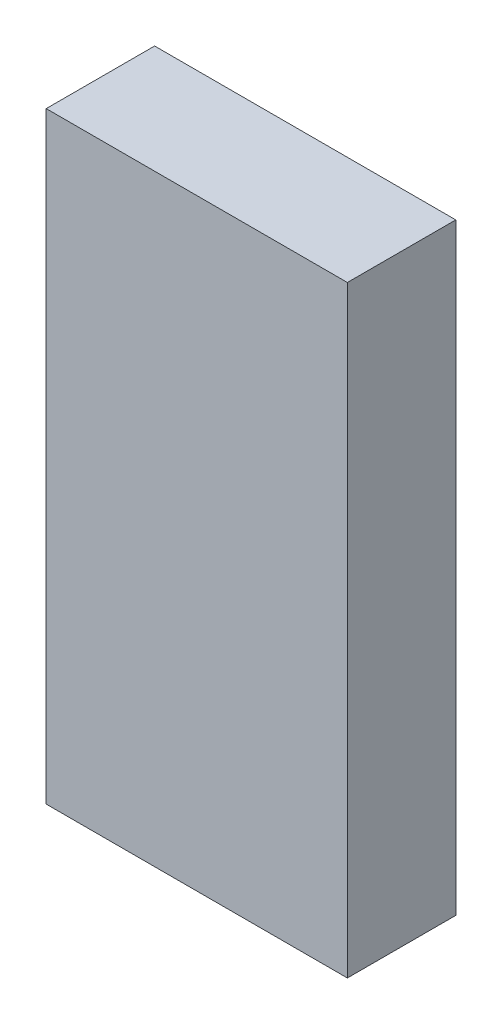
SolidWorks part; units mm, degrees
ref_plane "Front Plane" through (0, 0, 0) normal (0, 0, 1) x (1, 0, 0)
ref_plane "Top Plane" through (0, 0, 0) normal (0, 1, 0) x (1, 0, 0)
ref_plane "Right Plane" through (0, 0, 0) normal (1, 0, 0) x (0, 0, -1)
sketch "Sketch1" plane through (0, 0, 0) normal (0, 0, 1) x (1, 0, 0)
  line L1 (-50, 100) -> (50, 100)
  line L2 (-50, 100) -> (-50, -100)
  line L3 (-50, -100) -> (50, -100)
  line L4 (50, 100) -> (50, -100)
  line L5 (-50, 100) -> (50, -100) construction
  line L6 (-50, -100) -> (50, 100) construction
  point P0 (0, 0)
  dimension "D1" = 200
  dimension "D2" = 100
extrude "Boss-Extrude1" add sketch "Sketch1" along normal blind 36
sketch "Sketch4" plane through (0, 0, 0) normal (0, 0, -1) x (-1, 0, 0)
  line L0 (-50, -100) -> (-50, 100) construction
  line L1 (-35, 85) -> (35, 85)
  line L2 (-35, 85) -> (-35, -85)
  line L3 (-35, -85) -> (35, -85)
  line L4 (35, 85) -> (35, -85)
  line L5 (-35, 85) -> (35, -85) construction
  line L6 (-35, -85) -> (35, 85) construction
  line L7 (-50, 100) -> (50, 100) construction
  point P0 (0, 0)
  dimension "D1" = 15
  dimension "D2" = 15
extrude "Cut-Extrude1" cut sketch "Sketch4" against normal blind 28
fillet "Fillet1" radius 10 8 edges at (0, -85, 28) (35, 0, 28) (0, 85, 28) (-35, 0, 28) (-35, -85, 14) (-35, 85, 14) (35, -85, 14) (35, 85, 14)
sketch "Sketch5" plane through (0, 0, 0) normal (0, 0, -1) x (-1, 0, 0)
  line L0 (-50, 100) -> (50, 100) construction
  line L1 (-45, 95) -> (45, 95)
  line L2 (-45, 95) -> (-45, -95)
  line L3 (-45, -95) -> (45, -95)
  line L4 (45, 95) -> (45, -95)
  line L5 (-45, 95) -> (45, -95) construction
  line L6 (-45, -95) -> (45, 95) construction
  line L7 (50, 100) -> (50, -100) construction
  point P0 (0, 0)
  dimension "D1" = 5
  dimension "D2" = 5
extrude "Cut-Extrude2" cut sketch "Sketch5" against normal blind 5
